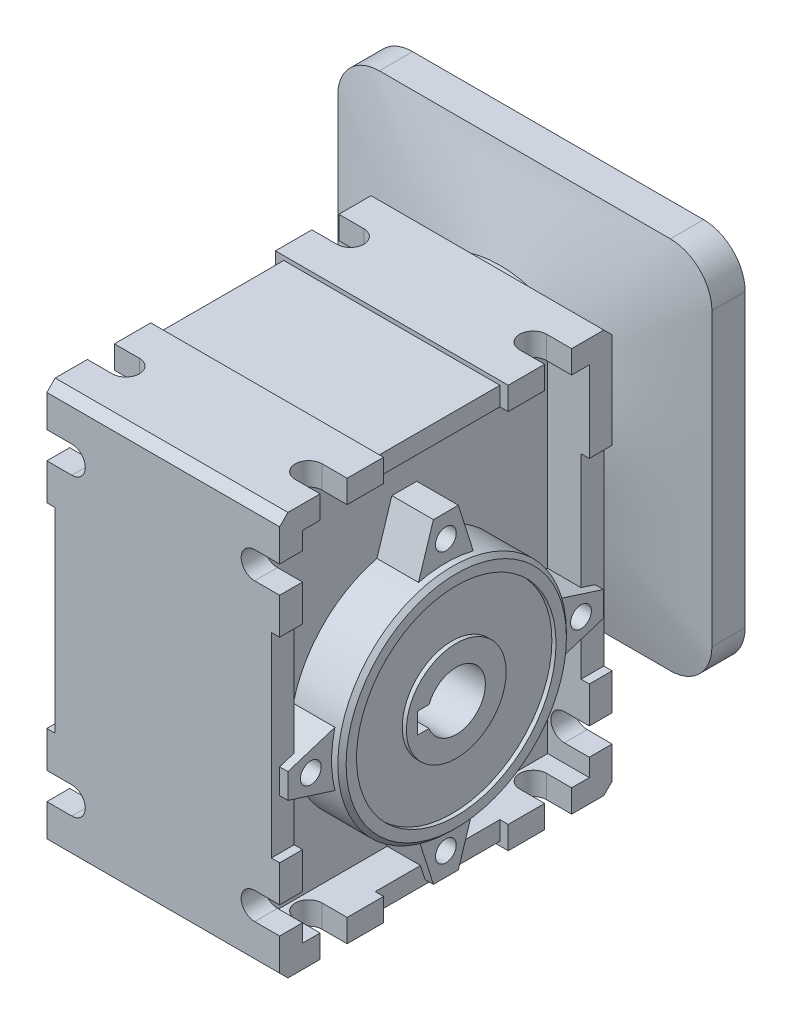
SolidWorks part; units mm, degrees
ref_plane "前视基准面" through (0, 0, 0) normal (0, 0, 1) x (1, 0, 0)
ref_plane "上视基准面" through (0, 0, 0) normal (0, 1, 0) x (1, 0, 0)
ref_plane "右视基准面" through (0, 0, 0) normal (1, 0, 0) x (0, 0, -1)
sketch "草图1" plane through (0, 0, 0) normal (1, 0, 0) x (0, 0, -1)
  line L1 (-38, -40) -> (38, -40)
  line L2 (-40, -38) -> (-40, 55)
  line L3 (-38, 57) -> (38, 57)
  line L4 (40, 55) -> (40, -38)
  line L5 (-40, 55) -> (-38, 57)
  line L6 (38, 57) -> (40, 55)
  line L7 (40, -38) -> (38, -40)
  line L8 (-40, -38) -> (-38, -40)
  point P5 (-40, -40)
  point P6 (-40, 57)
  point P7 (40, 57)
  point P8 (40, -40)
extrude "凸台-拉伸1" add sketch "草图1" along normal blind 56
sketch "草图2" plane through (56, 0, 0) normal (1, 0, 0) x (0, 0, -1)
  line L4 (34.5, 51.5) -> (34.5, -34.5)
  line L5 (34.5, -34.5) -> (-34.5, -34.5)
  line L6 (-34.5, -34.5) -> (-34.5, 51.5)
  line L7 (-34.5, 51.5) -> (34.5, 51.5)
extrude "切除-拉伸1" cut sketch "草图2" against normal blind 10
sketch "草图3" plane through (0, 0, 0) normal (-1, 0, 0) x (0, 0, 1)
  line L4 (34.5, 51.5) -> (34.5, -34.5)
  line L5 (34.5, -34.5) -> (-34.5, -34.5)
  line L6 (-34.5, -34.5) -> (-34.5, 51.5)
  line L7 (-34.5, 51.5) -> (34.5, 51.5)
extrude "切除-拉伸2" cut sketch "草图3" against normal blind 10
sketch "草图4" plane through (0, 0, 0) normal (-1, 0, 0) x (0, 0, 1)
  line L0 (-15, 57) -> (-15, 56)
  line L1 (-38, 57) -> (38, 57) construction
  line L2 (-15, 57) -> (15, 57)
  line L3 (-15, 56) -> (15, 56)
  line L4 (15, 56) -> (15, 57)
  line L5 (-15, -40) -> (15, -40)
  line L6 (38, -40) -> (-38, -40) construction
  line L7 (15, -40) -> (15, -39)
  line L8 (15, -39) -> (-15, -39)
  line L9 (-15, -39) -> (-15, -40)
extrude "切除-拉伸3" cut sketch "草图4" against normal blind 58
sketch "草图6" plane through (0, 0, 0) normal (-1, 0, 0) x (0, 0, 1)
  line L0 (-40, 55) -> (-40, 32)
  line L2 (-40, -38) -> (-40, 55) construction
  line L3 (-40, 32) -> (-40, -15)
  line L4 (-40, -15) -> (-39, -15)
  line L5 (-39, -15) -> (-39, 32)
  line L6 (-39, 32) -> (-40, 32)
  line L7 (40, 32) -> (40, -15)
  line L8 (40, 55) -> (40, -38) construction
  line L9 (40, -15) -> (39, -15)
  line L10 (39, -15) -> (39, 32)
  line L11 (39, 32) -> (40, 32)
extrude "切除-拉伸4" cut sketch "草图6" against normal blind 58 contours L3 L4 L5 L6 | L7 L9 L10 L11
sketch "草图7" plane through (10, 0, 0) normal (-1, 0, 0) x (0, 0, 1)
  line L0 (38, 3) -> (37.8814, -3)
  line L2 (-38, -3) -> (-38, 3)
  line L3 (37.8814, -3) -> (26.7, -6.5848)
  line L5 (-26.7, -6.5848) -> (-38, -3)
  line L6 (-38, 3) -> (-26.7, 6.5848)
  line L7 (26.7, 6.5848) -> (38, 3)
  line L8 (-3, 38) -> (3, 38)
  line L13 (5.8909, 26.8616) -> (3, 38)
  line L14 (-3, 38) -> (-6.5848, 26.7)
  line L15 (-3, -37.8814) -> (-6.5848, -26.7)
  line L17 (5.8909, -26.8616) -> (3, -37.8814)
  line L18 (3, -37.8814) -> (-3, -37.8814)
  arc A0 (-6.5848, 26.7) -> (-26.7, 6.5848) centre (0, 0) ccw
  arc A1 (26.7, 6.5848) -> (5.8909, 26.8616) centre (0, 0) ccw
  arc A3 (-26.7, -6.5848) -> (-6.5848, -26.7) centre (0, 0) ccw
  arc A4 (5.8909, -26.8616) -> (26.7, -6.5848) centre (0, 0) ccw
extrude "凸台-拉伸3" add sketch "草图7" along normal blind 10 separate body
sketch "草图8" plane through (46, 0, 0) normal (1, 0, 0) x (0, 0, -1)
  line L4 (-26.7, 6.5848) -> (-38, 3)
  line L6 (-26.7, -6.5848) -> (-38, -3)
  line L8 (-38, 3) -> (-38, -3)
  line L11 (37.8814, 3) -> (37.8814, -3)
  line L13 (-3, 38) -> (3, 38)
  line L14 (26.7, -6.5848) -> (37.8814, -3)
  line L17 (26.7, 6.5848) -> (37.8814, 3)
  line L19 (-6.5848, 26.7) -> (-3, 38)
  line L21 (6.5848, 26.7) -> (3, 38)
  line L23 (-6.5848, -26.7) -> (-3, -38)
  line L25 (6.5848, -26.7) -> (3, -38)
  line L27 (3, -38) -> (-3, -38)
  arc A0 (6.5848, -26.7) -> (26.7, -6.5848) centre (0, 0) ccw
  arc A2 (-26.7, -6.5848) -> (-6.5848, -26.7) centre (0, 0) ccw
  arc A3 (-6.5848, 26.7) -> (-26.7, 6.5848) centre (0, 0) ccw
  arc A4 (26.7, 6.5848) -> (6.5848, 26.7) centre (0, 0) ccw
extrude "凸台-拉伸4" add sketch "草图8" along normal blind 10 separate body
sketch "草图9" plane through (56, 0, 0) normal (1, 0, 0) x (0, 0, -1)
  line L0 (-15, 56) -> (-15, 51.5)
  line L1 (34.5, 51.5) -> (-34.5, 51.5) construction
  line L2 (-15, 56) -> (15, 56)
  line L3 (15, 56) -> (15, 51.5)
  line L4 (34.5, 51.5) -> (-34.5, 51.5) construction
  line L5 (15, 51.5) -> (-15, 51.5)
  line L6 (-39, 32) -> (-39, -15)
  line L7 (-39, -15) -> (-34.5, -15)
  line L8 (-34.5, 51.5) -> (-34.5, -34.5) construction
  line L9 (-34.5, -15) -> (-34.5, 32)
  line L10 (-34.5, 51.5) -> (-34.5, -34.5) construction
  line L11 (-34.5, 32) -> (-39, 32)
  line L12 (39, 32) -> (39, -15)
  line L13 (39, -15) -> (34.5, -15)
  line L14 (34.5, -34.5) -> (34.5, 51.5) construction
  line L15 (34.5, -15) -> (34.5, 32)
  line L16 (34.5, 32) -> (39, 32)
  line L18 (15, -39) -> (-15, -39)
  line L19 (-15, -39) -> (-15, -34.5)
  line L20 (-34.5, -34.5) -> (34.5, -34.5) construction
  line L21 (-15, -34.5) -> (15, -34.5)
  line L22 (-34.5, -34.5) -> (34.5, -34.5) construction
  line L23 (15, -34.5) -> (15, -39)
extrude "切除-拉伸5" cut sketch "草图9" against normal blind 10
sketch "草图10" plane through (0, 0, 0) normal (-1, 0, 0) x (0, 0, 1)
  line L0 (-15, 56) -> (15, 56)
  line L1 (15, 56) -> (15, 51.5)
  line L2 (34.5, 51.5) -> (-34.5, 51.5) construction
  line L3 (15, 51.5) -> (-15, 51.5)
  line L4 (-15, 51.5) -> (-15, 56)
  line L5 (-39, 32) -> (-39, -15)
  line L6 (-39, -15) -> (-34.5, -15)
  line L7 (-34.5, 51.5) -> (-34.5, -34.5) construction
  line L8 (-34.5, -15) -> (-34.5, 32)
  line L9 (-34.5, 51.5) -> (-34.5, -34.5) construction
  line L10 (-34.5, 32) -> (-39, 32)
  line L11 (39, 32) -> (39, -15)
  line L12 (39, -15) -> (34.5, -15)
  line L13 (34.5, -34.5) -> (34.5, 51.5) construction
  line L14 (34.5, -15) -> (34.5, 32)
  line L15 (34.5, 32) -> (39, 32)
  line L16 (15, -39) -> (-15, -39)
  line L17 (-15, -39) -> (-15, -34.5)
  line L18 (-34.5, -34.5) -> (34.5, -34.5) construction
  line L19 (-15, -34.5) -> (15, -34.5)
  line L20 (-34.5, -34.5) -> (34.5, -34.5) construction
  line L21 (15, -34.5) -> (15, -39)
extrude "切除-拉伸6" cut sketch "草图10" against normal blind 10
sketch "草图11" plane through (0, 0, 0) normal (-1, 0, 0) x (0, 0, 1)
  point P3 (0, 32.5)
  point P4 (-32.5, 0)
  point P5 (0, -32.5)
  point P6 (32.5, 0)
sketch "草图12" plane through (56, 0, 0) normal (1, 0, 0) x (0, 0, -1)
  point P0 (0, 32.5)
  point P1 (-32.5, 0)
  point P3 (0, -32.5)
  point P5 (32.5, 0)
hole_wizard "M6 螺纹孔1" positions "3D草图1" profile "草图13" tap size "M6" standard "GB"
sketch3d "3D草图1"
  point P0 (0, 32.5, 0)
  point P3 (0, 0, 32.5)
  point P6 (0, 0, -32.5)
  point P9 (0, -32.5, 0)
  point P12 (56, 32.5, 0)
  point P15 (0, 0, 32.5)
  point P17 (0, 0, -32.5)
  point P19 (0, -32.5, 0)
  point P21 (56, 0, 32.5)
  point P24 (56, -32.5, 0)
  point P27 (56, 0, -32.5)
sketch "草图13" plane through (0, 32.5, 0) normal (0, 1, 0) x (0, 0, 1)
  line L0 (0, 0) -> (0, 17.5022)
  line L1 (0, 17.5022) -> (2.5, 16)
  line L2 (2.5, 16) -> (2.5, 0)
  line L5 (2.5, 0) -> (0, 0)
  line L10 (0, 17.5022) -> (-2.5, 16) construction
  line L11 (0, -6.35) -> (0, 107.95) construction
  dimension "螺纹孔钻头直径" = 5
  dimension "螺纹孔钻头深度" = 16
  dimension "导头角度" = 118
sketch "草图14" plane through (0, 0, -39) normal (0, 0, -1) x (-1, 0, 0)
  line L0 (-46, 32) -> (-46, -15)
  line L1 (-46, -15) -> (-10, -15)
  line L2 (-10, -15) -> (-10, 32)
  line L3 (-10, 32) -> (-46, 32)
extrude "凸台-拉伸5" add sketch "草图14" along normal blind 1
sketch "草图16" plane through (0, 0, 40) normal (0, 0, 1) x (1, 0, 0)
  line L1 (0, 55) -> (0, 32) construction
  line L3 (6, 40.75) -> (0, 40.75)
  line L4 (0, 40.75) -> (0, 47.25)
  line L5 (0, 47.25) -> (6, 47.25)
  line L6 (50, 47.25) -> (56, 47.25)
  line L7 (56, 55) -> (56, 32) construction
  line L8 (56, 47.25) -> (56, 40.75)
  line L10 (50, 40.75) -> (56, 40.75)
  line L12 (0, -15) -> (0, -38) construction
  line L14 (6, -23.75) -> (0, -23.75)
  line L15 (0, -23.75) -> (0, -30.25)
  line L16 (0, -30.25) -> (6, -30.25)
  line L17 (50, -30.25) -> (56, -30.25)
  line L18 (56, -15) -> (56, -38) construction
  line L19 (56, -30.25) -> (56, -23.75)
  line L20 (56, -23.75) -> (50, -23.75)
  arc A0 (6, 40.75) -> (6, 47.25) centre (6, 44) ccw
  arc A1 (50, 47.25) -> (50, 40.75) centre (50, 44) ccw
  arc A2 (6, -30.25) -> (6, -23.75) centre (6, -27) ccw
  arc A3 (50, -23.75) -> (50, -30.25) centre (50, -27) ccw
sketch "草图17" plane through (0, 0, -40) normal (0, 0, -1) x (-1, 0, 0)
  line L12 (0, -38) -> (0, -15) construction
  line L14 (-50, -23.75) -> (-56, -23.75)
  line L15 (-56, -38) -> (-56, -15) construction
  line L16 (-56, -23.75) -> (-56, -30.25)
  line L17 (-56, -30.25) -> (-50, -30.25)
  line L18 (-6, -30.25) -> (0, -30.25)
  line L19 (0, -30.25) -> (0, -23.75)
  line L20 (0, -23.75) -> (-6, -23.75)
  arc A2 (-6, -23.75) -> (-6, -30.25) centre (-6, -27) ccw
  arc A3 (-50, -30.25) -> (-50, -23.75) centre (-50, -27) ccw
extrude "切除-拉伸7" cut sketch "草图17" against normal blind 5.5
extrude "切除-拉伸8" cut sketch "草图16" against normal blind 5.5
sketch "草图18" plane through (0, 57, 0) normal (0, 1, 0) x (1, 0, 0)
  line L3 (6, 30.25) -> (0, 30.25)
  line L4 (0, 30.25) -> (0, 23.75)
  line L5 (0, 23.75) -> (6, 23.75)
  line L6 (50, 23.75) -> (56, 23.75)
  line L7 (56, 38) -> (56, 15) construction
  line L8 (56, 23.75) -> (56, 30.25)
  line L10 (50, 30.25) -> (56, 30.25)
  line L12 (0, -15) -> (0, -38) construction
  line L14 (6, -23.75) -> (0, -23.75)
  line L15 (0, -23.75) -> (0, -30.25)
  line L16 (0, -30.25) -> (6, -30.25)
  line L17 (50, -30.25) -> (56, -30.25)
  line L18 (56, -15) -> (56, -38) construction
  line L19 (56, -30.25) -> (56, -23.75)
  line L20 (56, -23.75) -> (50, -23.75)
  arc A0 (6, 23.75) -> (6, 30.25) centre (6, 27) ccw
  arc A1 (50, 30.25) -> (50, 23.75) centre (50, 27) ccw
  arc A2 (6, -30.25) -> (6, -23.75) centre (6, -27) ccw
  arc A3 (50, -23.75) -> (50, -30.25) centre (50, -27) ccw
extrude "切除-拉伸9" cut sketch "草图18" against normal blind 5.5
sketch "草图19" plane through (0, -40, 0) normal (0, -1, 0) x (1, 0, 0)
  line L3 (0, -15) -> (0, -38) construction
  line L4 (6, -30.25) -> (0, -30.25)
  line L8 (6, 30.25) -> (0, 30.25)
  line L9 (0, 30.25) -> (0, 23.75)
  line L10 (0, 23.75) -> (6, 23.75)
  line L11 (50, 23.75) -> (56, 23.75)
  line L12 (56, 38) -> (56, 15) construction
  line L13 (56, 23.75) -> (56, 30.25)
  line L14 (56, 30.25) -> (50, 30.25)
  line L16 (50, -23.75) -> (56, -23.75)
  line L17 (56, -23.75) -> (56, -30.25)
  line L18 (56, -30.25) -> (50, -30.25)
  line L19 (0, -30.25) -> (0, -23.75)
  line L20 (0, -23.75) -> (6, -23.75)
  arc A0 (6, 23.75) -> (6, 30.25) centre (6, 27) ccw
  arc A1 (50, 30.25) -> (50, 23.75) centre (50, 27) ccw
  arc A2 (50, -23.75) -> (50, -30.25) centre (50, -27) ccw
  arc A3 (6, -30.25) -> (6, -23.75) centre (6, -27) ccw
extrude "切除-拉伸10" cut sketch "草图19" against normal blind 5.5
sketch "草图21" plane through (0, 0, -40) normal (0, 0, -1) x (-1, 0, 0)
  circle A1 centre (-28, 30) radius 25
extrude "凸台-拉伸6" add sketch "草图21" along normal blind 1
ref_plane "基准面1" through (0, 0, -47) normal (0, 0, 1) x (1, 0, 0)
sketch "草图22" plane through (0, 0, -41) normal (0, 0, -1) x (-1, 0, 0)
  circle A0 centre (-28, 30) radius 25
sketch "草图23" plane through (0, 0, -47) normal (0, 0, 1) x (1, 0, 0)
  line L7 (63, -15) -> (-7, -15)
  line L8 (73, -5) -> (73, 65)
  line L9 (63, 75) -> (-7, 75)
  line L10 (-17, -5) -> (-17, 65)
  line L11 (73, -15) -> (-17, 75) construction
  line L12 (73, 75) -> (-17, -15) construction
  arc A0 (73, 65) -> (63, 75) centre (63, 65) ccw
  arc A1 (63, -15) -> (73, -5) centre (63, -5) ccw
  arc A2 (-7, -15) -> (-17, -5) centre (-7, -5) cw
  arc A3 (-7, 75) -> (-17, 65) centre (-7, 65) ccw
  point P0 (28, 30)
  dimension "D1" = 10
sketch "草图24" plane through (10, 0, 0) normal (-1, 0, 0) x (0, 0, 1)
  line L0 (-34.5, 32) -> (-40, 32)
  line L1 (-40, 32) -> (-40, -15)
  line L2 (-40, -15) -> (-34.5, -15)
  line L3 (-34.5, -15) -> (-34.5, -4.1103)
  line L4 (-38, -3) -> (-26.7, -6.5848) construction
  line L5 (-34.5, -4.1103) -> (-38, -3)
  line L6 (-38, -3) -> (-38, 3)
  line L7 (-38, 3) -> (-34.5, 4.1103)
  line L8 (-26.7, 6.5848) -> (-38, 3) construction
  line L9 (-34.5, 4.1103) -> (-34.5, 32)
extrude "凸台-拉伸7" add sketch "草图24" along normal blind 8
sketch "草图25" plane through (46, 0, 0) normal (1, 0, 0) x (0, 0, -1)
  line L0 (40, 32) -> (40, -15)
  line L1 (40, -15) -> (34.5, -15)
  line L2 (34.5, -15) -> (34.5, -4.0841)
  line L3 (26.7, -6.5848) -> (37.8814, -3) construction
  line L4 (34.5, -4.0841) -> (37.8814, -3)
  line L5 (37.8814, -3) -> (37.8814, 3)
  line L6 (37.8814, 3) -> (34.5, 4.0841)
  line L7 (37.8814, 3) -> (26.7, 6.5848) construction
  line L8 (34.5, 4.0841) -> (34.5, 32)
  line L9 (34.5, 32) -> (40, 32)
extrude "凸台-拉伸8" add sketch "草图25" along normal blind 8
sketch "草图26" plane through (56, 0, 0) normal (1, 0, 0) x (0, 0, -1)
  circle A0 centre (0, 0) radius 27.5
extrude "凸台-拉伸9" add sketch "草图26" along normal blind 2.5
sketch "草图27" plane through (0, 0, 0) normal (-1, 0, 0) x (0, 0, 1)
  circle A0 centre (0, 0) radius 27.5
extrude "凸台-拉伸10" add sketch "草图27" along normal blind 2.5
chamfer "倒角2" distance 1 angle 45 2 edges at (58.5, 0, -27.5) (-2.5, 0, 27.5)
sketch "草图28" plane through (58.5, 0, 0) normal (1, 0, 0) x (0, 0, -1)
  line L2 (-9.3, 2.5) -> (-6.5383, 2.5)
  line L4 (-6.5383, -2.5) -> (-9.3, -2.5)
  line L5 (-9.3, -2.5) -> (-9.3, 2.5)
  arc A0 (-6.5383, -2.5) -> (-6.5383, 2.5) centre (0, 0) ccw
extrude "切除-拉伸11" cut sketch "草图28" against normal blind 63
sketch "草图29" plane through (58.5, 0, 0) normal (1, 0, 0) x (0, 0, -1)
  line L0 (-6.5383, 2.5) -> (-9.3, 2.5)
  line L1 (-9.3, 2.5) -> (-9.3, -2.5)
  line L2 (-9.3, -2.5) -> (-6.5383, -2.5)
  circle A0 centre (0, 0) radius 24
  arc A1 (-6.5383, -2.5) -> (-6.5383, 2.5) centre (0, 0) ccw
extrude "切除-拉伸12" cut sketch "草图29" against normal blind 1
sketch "草图30" plane through (-2.5, 0, 0) normal (-1, 0, 0) x (0, 0, 1)
  line L0 (6.5383, 2.5) -> (9.3, 2.5)
  line L1 (9.3, 2.5) -> (9.3, -2.5)
  line L2 (9.3, -2.5) -> (6.5383, -2.5)
  circle A0 centre (0, 0) radius 24
  arc A1 (6.5383, 2.5) -> (6.5383, -2.5) centre (0, 0) ccw
extrude "切除-拉伸13" cut sketch "草图30" against normal blind 1
sketch "草图31" plane through (-1.5, 0, 0) normal (-1, 0, 0) x (0, 0, 1)
  line L0 (6.5383, 2.5) -> (9.3, 2.5)
  line L1 (9.3, 2.5) -> (9.3, -2.5)
  line L2 (9.3, -2.5) -> (6.5383, -2.5)
  arc A0 (6.5383, 2.5) -> (6.5383, -2.5) centre (0, 0) ccw
  circle A1 centre (0, 0) radius 12
extrude "凸台-拉伸11" add sketch "草图31" along normal blind 1
sketch "草图32" plane through (57.5, 0, 0) normal (1, 0, 0) x (0, 0, -1)
  line L0 (-6.5383, 2.5) -> (-9.3, 2.5)
  line L1 (-9.3, 2.5) -> (-9.3, -2.5)
  line L2 (-9.3, -2.5) -> (-6.5383, -2.5)
  circle A0 centre (0, 0) radius 12
  arc A1 (-6.5383, -2.5) -> (-6.5383, 2.5) centre (0, 0) ccw
extrude "凸台-拉伸12" add sketch "草图32" along normal blind 1
sketch "草图34" plane through (0, 0, 39) normal (0, 0, 1) x (1, 0, 0)
  line L0 (10, 32) -> (10, -15)
  line L1 (10, -15) -> (46, -15)
  line L2 (46, -15) -> (46, 32)
  line L3 (10, 32) -> (46, 32)
extrude "凸台-拉伸14" add sketch "草图34" along normal blind 1
sketch "草图37" plane through (46, 0, 0) normal (1, 0, 0) x (0, 0, -1)
  line L0 (-15, 56) -> (15, 56)
  line L1 (15, 56) -> (15, 51.5)
  line L2 (15, 51.5) -> (-15, 51.5)
  line L3 (-15, 51.5) -> (-15, 56)
  line L4 (-34.5, 32) -> (-40, 32)
  line L5 (-40, 32) -> (-40, -15)
  line L6 (-40, -15) -> (-34.5, -15)
  line L7 (-34.5, -15) -> (-34.5, -4.1103)
  line L8 (-38, -3) -> (-26.7, -6.5848) construction
  line L9 (-34.5, -4.1103) -> (-38, -3)
  line L10 (-38, -3) -> (-38, 3)
  line L11 (-38, 3) -> (-34.5, 4.1103)
  line L12 (-26.7, 6.5848) -> (-38, 3) construction
  line L13 (-34.5, 4.1103) -> (-34.5, 32)
  line L14 (-15, -34.5) -> (-15, -39)
  line L15 (-15, -39) -> (15, -39)
  line L16 (15, -39) -> (15, -34.5)
  line L17 (15, -34.5) -> (4.1103, -34.5)
  line L18 (3, -38) -> (6.5848, -26.7) construction
  line L19 (4.1103, -34.5) -> (3, -38)
  line L20 (3, -38) -> (-3, -38)
  line L21 (-3, -38) -> (-4.1103, -34.5)
  line L22 (-6.5848, -26.7) -> (-3, -38) construction
  line L23 (-4.1103, -34.5) -> (-15, -34.5)
extrude "凸台-拉伸17" add sketch "草图37" along normal blind 8
sketch "草图38" plane through (10, 0, 0) normal (-1, 0, 0) x (0, 0, 1)
  line L0 (-15, 56) -> (15, 56)
  line L1 (15, 56) -> (15, 51.5)
  line L2 (15, 51.5) -> (-15, 51.5)
  line L3 (-15, 51.5) -> (-15, 56)
  line L4 (34.5, 4.1103) -> (34.5, 32)
  line L5 (38, 3) -> (26.7, 6.5848) construction
  line L6 (34.5, 4.1103) -> (38, 3)
  line L7 (38, 3) -> (37.8814, -3)
  line L8 (37.8814, -3) -> (34.5, -4.0841)
  line L9 (26.7, -6.5848) -> (37.8814, -3) construction
  line L10 (34.5, -4.0841) -> (34.5, -15)
  line L11 (34.5, -15) -> (40, -15)
  line L12 (40, -15) -> (40, 32)
  line L13 (15, -39) -> (-15, -39)
  line L14 (-15, -39) -> (-15, -34.5)
  line L15 (-15, -34.5) -> (-4.0841, -34.5)
  line L16 (-6.5848, -26.7) -> (-3, -37.8814) construction
  line L17 (-4.0841, -34.5) -> (-3, -37.8814)
  line L18 (-3, -37.8814) -> (3, -37.8814)
  line L19 (3, -37.8814) -> (3.8871, -34.5)
  line L20 (3, -37.8814) -> (5.8909, -26.8616) construction
  line L21 (3.8871, -34.5) -> (15, -34.5)
  line L22 (15, -34.5) -> (15, -39)
  line L23 (34.5, 32) -> (40, 32)
extrude "凸台-拉伸18" add sketch "草图38" along normal blind 8
loft "放样1" add profiles "草图23", "草图22"
sketch "草图40" plane through (0, 0, -47) normal (0, 0, -1) x (-1, 0, 0)
  line L0 (-63, 75) -> (7, 75) construction
  line L1 (-63, -15) -> (7, -15)
  line L2 (-73, -5) -> (-73, 65)
  line L3 (-63, 75) -> (7, 75)
  line L4 (17, -5) -> (17, 65)
  line L5 (-73, -15) -> (17, 75) construction
  line L6 (-73, 75) -> (17, -15) construction
  arc A0 (-63, -15) -> (-73, -5) centre (-63, -5) cw
  arc A1 (7, -15) -> (17, -5) centre (7, -5) ccw
  arc A2 (7, 75) -> (17, 65) centre (7, 65) cw
  arc A3 (-73, 65) -> (-63, 75) centre (-63, 65) cw
  point P0 (-28, 30)
  dimension "D1" = 10
extrude "凸台-拉伸19" add sketch "草图40" along normal blind 8 separate body
